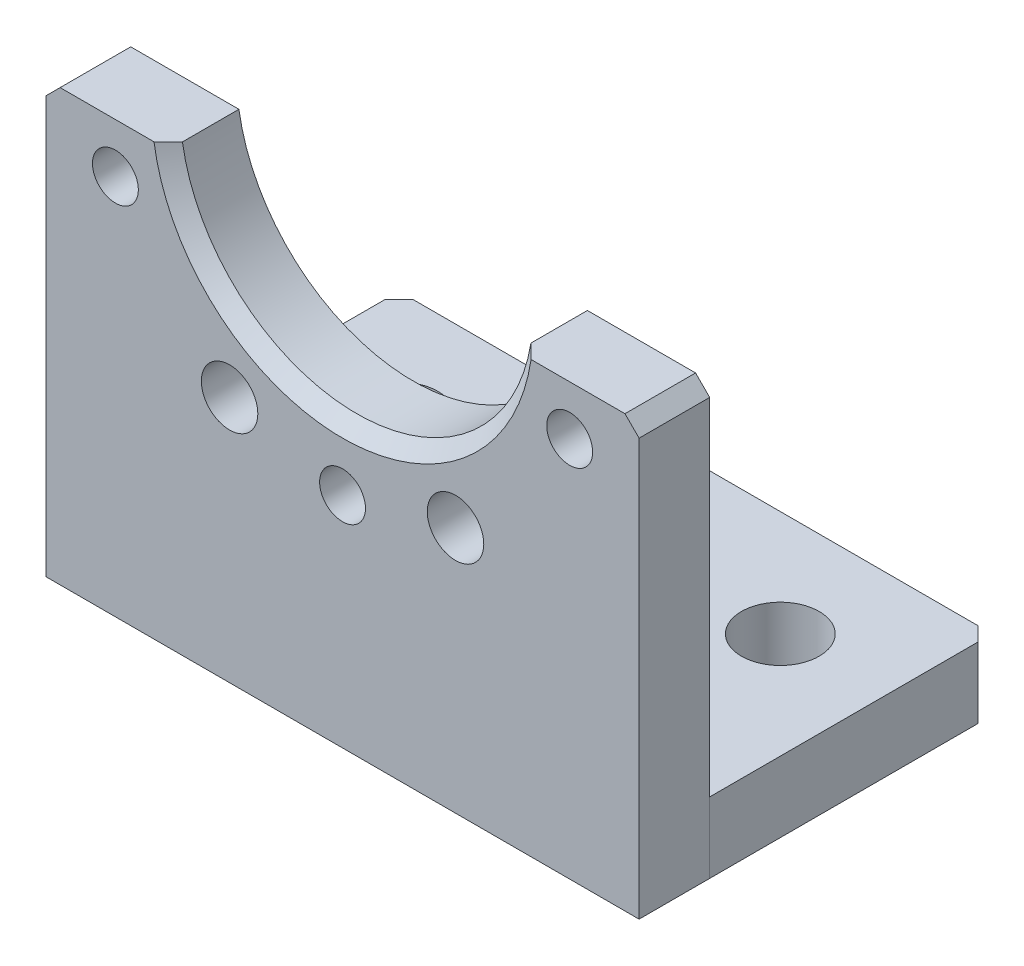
SolidWorks part; units mm, degrees
ref_plane "正面" through (0, 0, 0) normal (0, 0, 1) x (1, 0, 0)
ref_plane "平面" through (0, 0, 0) normal (0, 1, 0) x (1, 0, 0)
ref_plane "右側面" through (0, 0, 0) normal (1, 0, 0) x (0, 0, -1)
sketch "s-切り欠き中心" plane through (0, 0, 0) normal (0, 0, 1) x (1, 0, 0)
  line L0 (0, 0) -> (0, 65) construction
  circle A0 centre (0, 65) radius 25
  dimension "D1" = 50
  dimension "D2" = 65
sketch "s-穴位置1" plane through (0, 0, 0) normal (0, 0, 1) x (1, 0, 0)
  circle A0 centre (0, 65) radius 34
  dimension "D1" = 68
sketch "s-穴位置2" plane through (0, 0, 0) normal (0, 0, 1) x (1, 0, 0)
  line L1 (32.1714, 54) -> (-32.1714, 54) construction
  circle A1 centre (0, 65) radius 34 construction
  point P0 (32.1714, 54)
  point P5 (-32.1714, 54)
  dimension "D1" = 54
sketch "s-穴位置3" plane through (0, 0, 0) normal (0, 0, 1) x (1, 0, 0)
  line L0 (0, 0) -> (0, 65) construction
  circle A0 centre (0, 65) radius 34 construction
  point P0 (-16, 35)
  point P1 (16, 35)
  dimension "D1" = 16
  dimension "D2" = 16
sketch "s-穴位置4" plane through (0, 0, 0) normal (0, 1, 0) x (1, 0, 0)
  line L0 (0, 0) -> (0, 35) construction
  line L1 (-27, 35) -> (27, 35) construction
  dimension "D1" = 35
  dimension "D2" = 54
sketch "ｽｹｯﾁ6" plane through (0, 0, 0) normal (0, 0, 1) x (1, 0, 0)
  line L1 (-42, 0) -> (42, 0)
  line L2 (-42, 0) -> (-42, 61)
  line L3 (-42, 61) -> (42, 61)
  line L4 (42, 0) -> (42, 61)
  dimension "D1" = 84
  dimension "D2" = 61
extrude "ﾎﾞｽ - 押し出し1" add sketch "ｽｹｯﾁ6" against normal blind 50
shell "ｼｪﾙ1" thickness 10
sketch "ｽｹｯﾁ7" plane through (0, 0, 0) normal (0, 0, 1) x (1, 0, 0)
  circle A0 centre (0, 65) radius 25 construction
  circle A1 centre (0, 65) radius 25
extrude "ｶｯﾄ - 押し出し1" cut sketch "ｽｹｯﾁ7" against normal through all
sketch "ｽｹｯﾁ8" plane through (0, 0, 0) normal (0, 0, 1) x (1, 0, 0)
  circle A0 centre (0, 31) radius 3.25
  circle A1 centre (0, 65) radius 34 construction
  dimension "D1" = 6.5
extrude "ｶｯﾄ - 押し出し2" cut sketch "ｽｹｯﾁ8" against normal through all
pattern_sketch "ｽｹｯﾁ-ﾊﾟﾀｰﾝ1" of "ｶｯﾄ - 押し出し2"
chamfer "面取り1" distance 2 angle 45 1 edges at (0, 40, 0)
chamfer "面取り2" distance 2 angle 45 4 edges at (-42, 5, -50) (42, 5, -50) (-42, 61, -5) (42, 61, -5)
sketch "ｽｹｯﾁ9" plane through (0, 0, 0) normal (0, 0, 1) x (1, 0, 0)
  circle A0 centre (-16, 35) radius 4
  circle A1 centre (16, 35) radius 4
  dimension "D1" = 8
extrude "ｶｯﾄ - 押し出し3" cut sketch "ｽｹｯﾁ9" against normal through all
sketch "ｽｹｯﾁ10" plane through (0, 10, 0) normal (0, 1, 0) x (1, 0, 0)
  circle A0 centre (-27, 35) radius 5.5
  circle A1 centre (27, 35) radius 5.5
  dimension "D1" = 11
extrude "ｶｯﾄ - 押し出し4" cut sketch "ｽｹｯﾁ10" against normal through all
split "部品分割1" bodies to split 105 resulting bodies 106 107
